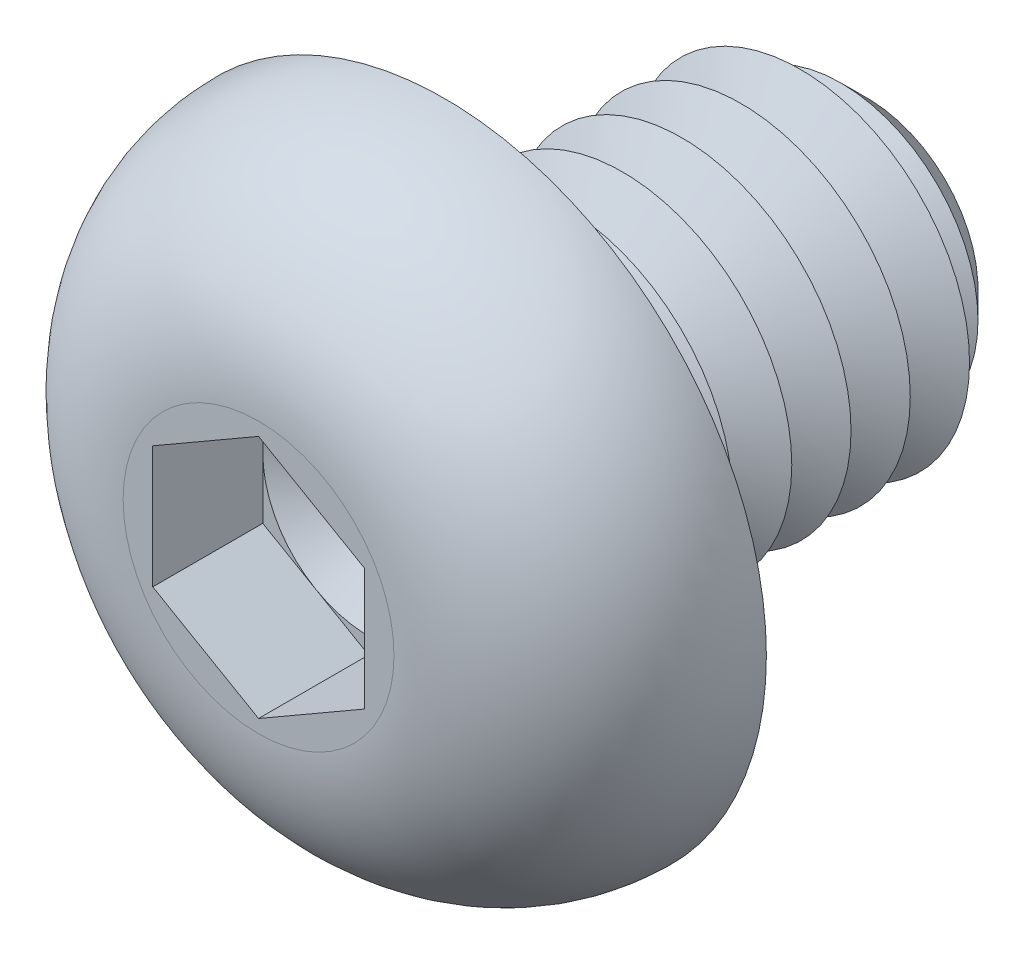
SolidWorks part; units mm, degrees
ref_plane "Front Plane" through (0, 0, 0) normal (0, 0, 1) x (1, 0, 0)
ref_plane "Top Plane" through (0, 0, 0) normal (0, 1, 0) x (1, 0, 0)
ref_plane "Right Plane" through (0, 0, 0) normal (1, 0, 0) x (0, 0, -1)
sketch "Sketch1" plane through (0, 0, 0) normal (1, 0, 0) x (0, 0, -1)
  line L0 (-47.9342, 0) -> (60.3146, 0) construction
sketch "Sketch2" plane through (0, 0, 0) normal (1, 0, 0) x (0, 0, -1)
  line L0 (0, 0) -> (-2.2, 0)
  line L1 (-47.9342, 0) -> (60.3146, 0) construction
  line L2 (-2.2, 0) -> (-2.2, 1.6)
  line L3 (0, 3.8) -> (0, 0)
  arc A0 (-2.2, 1.6) -> (0, 3.8) centre (0, 1.6) cw
  dimension "D1" = 2.2
  dimension "D2" = 2.2
  dimension "D3" = 3.8
revolve "Revolve1" add sketch "Sketch2" angle 360 about L0
sketch "Sketch3" plane through (0, 0, 2.2) normal (0, 0, 1) x (1, 0, 0)
  line L1 (0, 1.4434) -> (-1.25, 0.7217)
  line L2 (-1.25, 0.7217) -> (-1.25, -0.7217)
  line L3 (-1.25, -0.7217) -> (0, -1.4434)
  line L4 (0, -1.4434) -> (1.25, -0.7217)
  line L5 (1.25, -0.7217) -> (1.25, 0.7217)
  line L6 (1.25, 0.7217) -> (0, 1.4434)
  circle A0 centre (0, 0) radius 1.25 construction
  dimension "D1" = 2.5
extrude "Cut-Extrude1" cut sketch "Sketch3" against normal blind 1.3
sketch "Sketch4" plane through (0, 0, 0) normal (0, 0, -1) x (-1, 0, 0)
  circle A0 centre (0, 0) radius 2
  dimension "D1" = 4
extrude "Boss-Extrude1" add sketch "Sketch4" along normal blind 5
chamfer "Chamfer1" distance 0.7 angle 45 1 edges at (-2, 0, -5)
sketch "Sketch5" plane through (0, 0, 0) normal (1, 0, 0) x (0, 0, -1)
  line L0 (0.7, 2) -> (1.4, 2)
  line L1 (4.3, 2) -> (0, 2) construction
  line L2 (1.4, 2) -> (1.05, 1.3938)
  line L3 (1.05, 1.3938) -> (0.7, 2)
  line L4 (0, -3.8) -> (0, 3.8) construction
  line L5 (4.3, 2) -> (0, 2) construction
  dimension "D1" = 0.7
  dimension "D2" = 0.7
revolve "Cut-Revolve1" cut sketch "Sketch5" angle 360 about L0
pattern_linear "LPattern1" count 6 spacing 0.7 along (0, 0, -1) of "Cut-Revolve1"
fillet "Fillet2" radius 0.3 1 edges at (2, 0, 0)
sketch "Sketch6" plane through (0, 0, 0.9) normal (0, 0, 1) x (1, 0, 0)
  line L0 (0, -1.4434) -> (1.25, -0.7217) construction
  circle A0 centre (0, 0) radius 1.25
extrude "Cut-Extrude2" cut sketch "Sketch6" against normal through all draft 60
